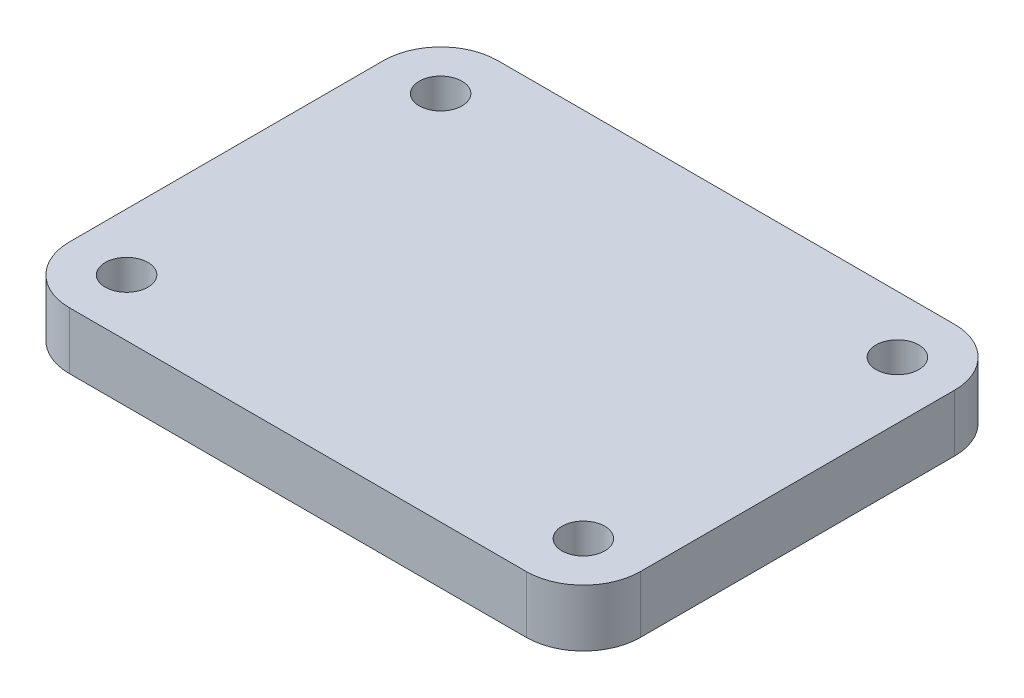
SolidWorks part; units mm, degrees
ref_plane "Front Plane" through (0, 0, 0) normal (0, 0, 1) x (1, 0, 0)
ref_plane "Top Plane" through (0, 0, 0) normal (0, 1, 0) x (1, 0, 0)
ref_plane "Right Plane" through (0, 0, 0) normal (1, 0, 0) x (0, 0, -1)
sketch "Sketch1" plane through (0, 0, 0) normal (0, 1, 0) x (1, 0, 0)
  line L0 (-100, 75) -> (100, -75) construction
  line L1 (-100, -75) -> (100, -75)
  line L2 (-100, -75) -> (-100, 75)
  line L3 (-100, 75) -> (100, 75)
  line L4 (100, -75) -> (100, 75)
  dimension "D1" = 200
  dimension "D2" = 150
extrude "Extrude1" add sketch "Sketch1" along normal blind 20
fillet "Fillet1" radius 20 4 edges at (-100, 10, -75) (100, 10, -75) (100, 10, 75) (-100, 10, 75)
hole_wizard "Hole1" positions "3DSketch1" profile "Sketch3" legacy
sketch3d "3DSketch1"
  arc A0 (-100, 20, 55) -> (-80, 20, 75) centre (-80, 20, 55) ccw construction
  point P0 (-80, 20, 55)
  point P6 (-80, 40, 55)
sketch "Sketch3" plane through (-80, 20, 55) normal (1, 0, 0) x (0, 0, 1)
  line L0 (0, 0) -> (0, 20)
  line L1 (0, 20) -> (7.5, 20)
  line L2 (7.5, 20) -> (7.5, 0)
  line L3 (7.5, 0) -> (0, 0)
  line L4 (0, 110) -> (0, -10) construction
  dimension "Diameter" = 15
  dimension "Depth" = 20
pattern_linear "LPattern1" count 2 spacing 160 along (1, 0, 0) count 2 spacing 110 along (0, 0, -1) of "Hole1"
